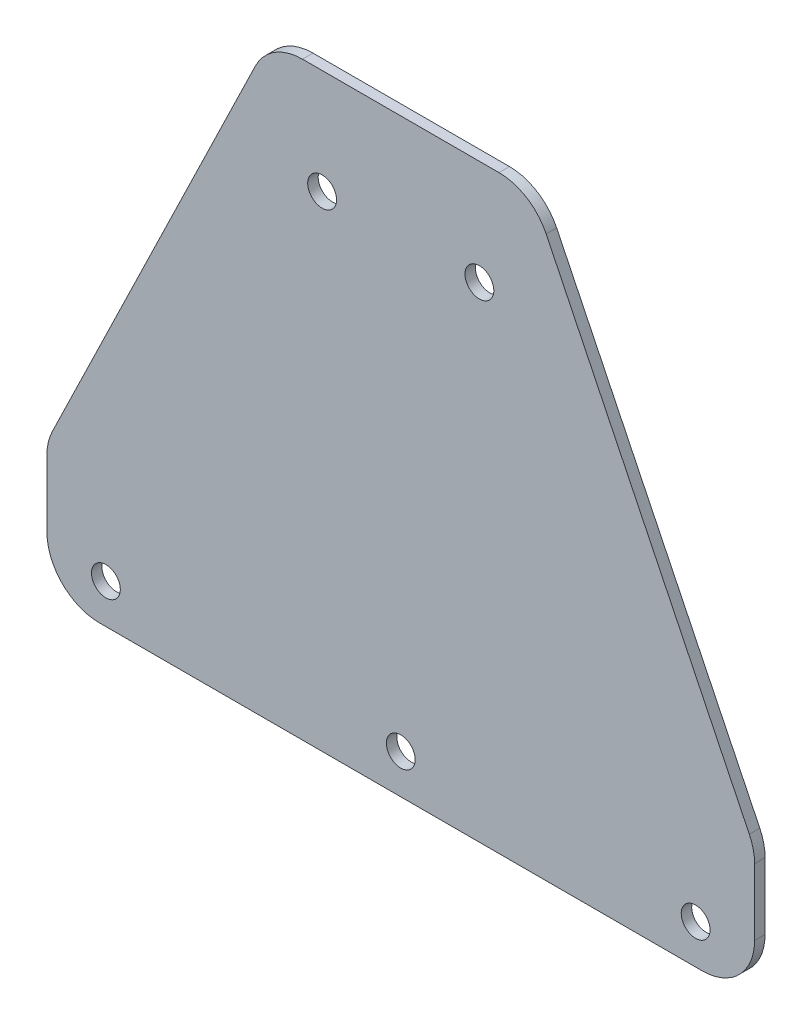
SolidWorks part; units mm, degrees
ref_plane "Plan_Face" through (0, 0, 0) normal (0, 0, 1) x (1, 0, 0)
ref_plane "Plan_Dessus" through (0, 0, 0) normal (0, 1, 0) x (1, 0, 0)
ref_plane "Plan_Droite" through (0, 0, 0) normal (1, 0, 0) x (0, 0, -1)
sketch "Esquisse1" plane through (0, 0, 0) normal (0, 0, 1) x (1, 0, 0)
  line L0 (0, 59.8513) -> (0, -54.4103) construction
  line L1 (135, 0) -> (-135, 0)
  line L2 (-135, 0) -> (-135, 50)
  line L3 (-135, 50) -> (-50, 225)
  line L4 (-50, 225) -> (50, 225)
  line L5 (135, 0) -> (135, 50)
  line L6 (135, 50) -> (50, 225)
  point P9 (0, 0)
  point P11 (0, 225)
  dimension "D1" = 270
  dimension "D2" = 100
  dimension "D3" = 225
  dimension "D4" = 50
extrude "Extrusion1" add sketch "Esquisse1" along normal blind 4
fillet "Congé1" radius 20 6 edges at (135, 50, 2) (135, 0, 2) (-135, 0, 2) (-135, 50, 2) (-50, 225, 2) (50, 225, 2)
sketch "Esquisse2" plane through (0, 0, 4) normal (0, 0, 1) x (1, 0, 0)
  line L0 (0, -13.5081) -> (0, 231.8761) construction
  line L1 (-115, 0) -> (115, 0) construction
  circle A0 centre (0, 15) radius 5.5
  circle A1 centre (-112.5, 15) radius 5.5
  circle A2 centre (-30, 185) radius 5.5
  circle A3 centre (112.5, 15) radius 5.5
  circle A4 centre (30, 185) radius 5.5
  dimension "D1" = 60
  dimension "D4" = 11
  dimension "D2" = 170
  dimension "D3" = 15
  dimension "D5" = 225
extrude "Extrusion2" cut sketch "Esquisse2" against normal through all
